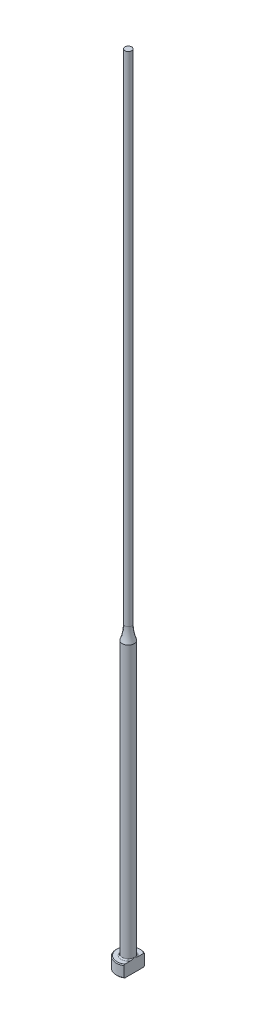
SolidWorks part; units mm, degrees
ref_plane "Front Plane" through (0, 0, 0) normal (0, 0, 1) x (1, 0, 0)
ref_plane "Top Plane" through (0, 0, 0) normal (0, 1, 0) x (1, 0, 0)
ref_plane "Right Plane" through (0, 0, 0) normal (1, 0, 0) x (0, 0, -1)
sketch "Sketch1" plane through (0, 0, 0) normal (0, 0, 1) x (1, 0, 0)
  line L0 (0, 259.9588) -> (0, -15.1925) construction
  line L1 (0, 0) -> (-3, 0)
  line L2 (-3, 0) -> (-3, 3)
  line L3 (-3, 3) -> (-1.5, 3)
  line L4 (-0.85, 75) -> (-0.85, 200)
  line L5 (-0.85, 200) -> (0, 200)
  line L6 (0, 200) -> (0, 0)
  line L7 (-1.5, 3) -> (-1.5, 71.4535)
  arc A0 (-1.5, 71.4535) -> (-0.85, 75) centre (-10.85, 75) ccw
  point P13 (-1.5, 0)
  dimension "D1" = 10
  dimension "L" = 200
  dimension "H" = 6
  dimension "T" = 3
  dimension "D" = 1.7
  dimension "B" = 3
  dimension "S" = 75
revolve "Revolve1" add sketch "Sketch1" angle 360 about L0
chamfer "Chamfer1" distance 0.2 angle 45 2 edges at (0, 3, 3) (0, 0, 3)
fillet "Fillet1" radius 0.3 1 edges at (0, 3, 1.5)
sketch "Sketch2" plane through (0, 0, 0) normal (0, 1, 0) x (1, 0, 0)
  line L0 (1.5, 2.5981) -> (1.5, -2.5981)
  circle A0 centre (0, 0) radius 3 construction
  arc A1 (1.5, -2.5981) -> (1.5, 2.5981) centre (0, 0) ccw
  circle A2 centre (0, 0) radius 1.5 construction
extrude "KEY" cut sketch "Sketch2" along normal through all
